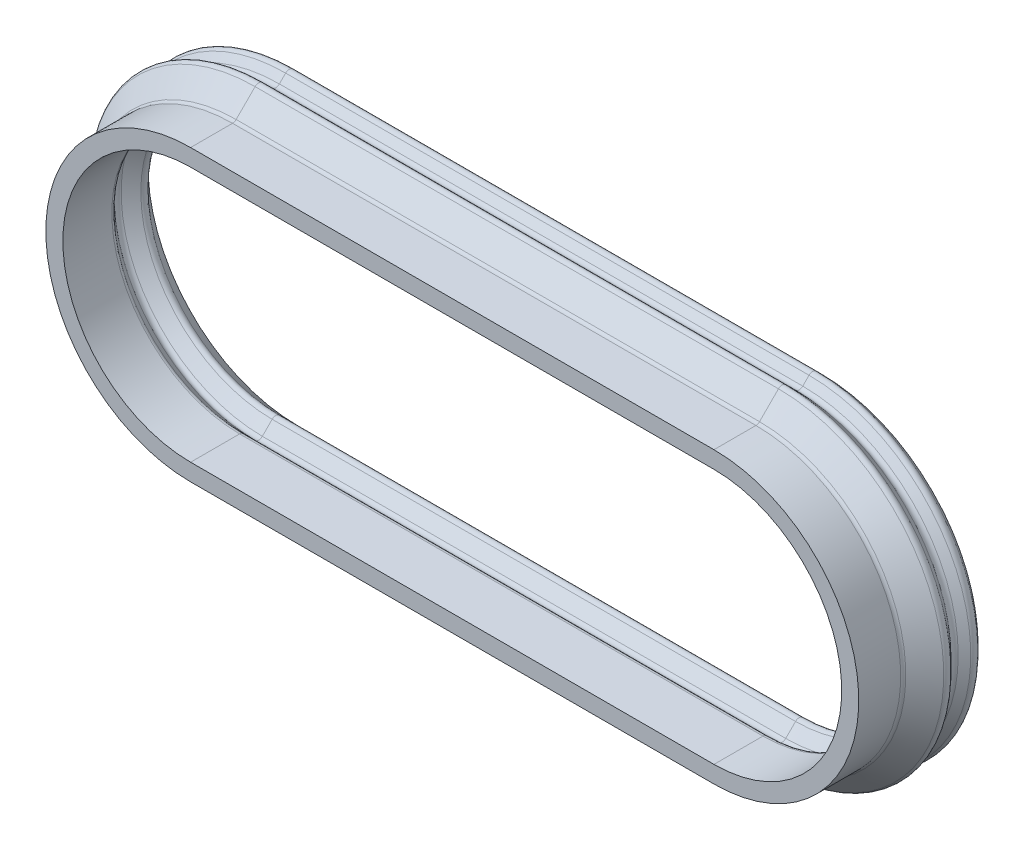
SolidWorks part; units mm, degrees
ref_plane "Front Plane" through (0, 0, 0) normal (0, 0, 1) x (1, 0, 0)
ref_plane "Top Plane" through (0, 0, 0) normal (0, 1, 0) x (1, 0, 0)
ref_plane "Right Plane" through (0, 0, 0) normal (1, 0, 0) x (0, 0, -1)
sketch "Sketch1" plane through (0, 0, 0) normal (0, 0, 1) x (1, 0, 0)
  line L0 (-3.9022, 0) -> (3.9022, 0) construction
  line L1 (-3.9022, 1.905) -> (3.9022, 1.905)
  line L2 (-3.9022, -1.905) -> (3.9022, -1.905)
  arc A0 (-3.9022, 1.905) -> (-3.9022, -1.905) centre (-3.9022, 0) ccw
  arc A1 (3.9022, -1.905) -> (3.9022, 1.905) centre (3.9022, 0) ccw
  point P3 (0, 0)
  dimension "D1" = 1.905
  dimension "D2" = 7.8044
sketch "Sketch2" plane through (0, 0, 0) normal (1, 0, 0) x (0, 0, -1)
  line L0 (0, 1.905) -> (0.762, 1.905)
  line L1 (0, 1.905) -> (0, -1.905) construction
  line L2 (0.762, 1.905) -> (1.016, 2.159)
  line L3 (1.016, 2.159) -> (1.27, 1.905)
  line L4 (1.27, 1.905) -> (1.651, 2.286)
  line L6 (0, 2.159) -> (0.6568, 2.159)
  line L7 (0.6568, 2.159) -> (1.016, 2.5182)
  line L8 (1.016, 2.5182) -> (1.27, 2.2642)
  line L9 (1.27, 2.2642) -> (1.4714, 2.4656)
  line L10 (0, 2.159) -> (0, 1.905)
  line L11 (1.4714, 2.4656) -> (1.651, 2.286)
  dimension "D1" = 0.762
  dimension "D2" = 0.508
  dimension "D3" = 0.381
  dimension "D4" = 0.254
  dimension "D5" = 0.381
  dimension "D6" = 0.254
sweep "Sweep1" add profiles "Sketch2" path "Sketch1"
fillet "Fillet1" radius 0.0762 32 edges at (-5.8072, 0, -0.762) (-6.0612, 0, -1.016) (-5.8072, 0, -1.27) (-6.1882, 0, -1.651) (-6.3678, 0, -1.4714) (-6.1664, 0, -1.27) (-6.4204, 0, -1.016) (-6.0612, 0, -0.6568) (0, -1.905, -0.762) (0, -2.159, -1.016) (0, -1.905, -1.27) (0, -2.286, -1.651) (0, -2.4656, -1.4714) (0, -2.2642, -1.27) (0, -2.5182, -1.016) (0, -2.159, -0.6568) (5.8072, 0, -0.762) (6.0612, 0, -1.016) (5.8072, 0, -1.27) (6.1882, 0, -1.651) (6.3678, 0, -1.4714) (6.1664, 0, -1.27) (6.4204, 0, -1.016) (6.0612, 0, -0.6568)
